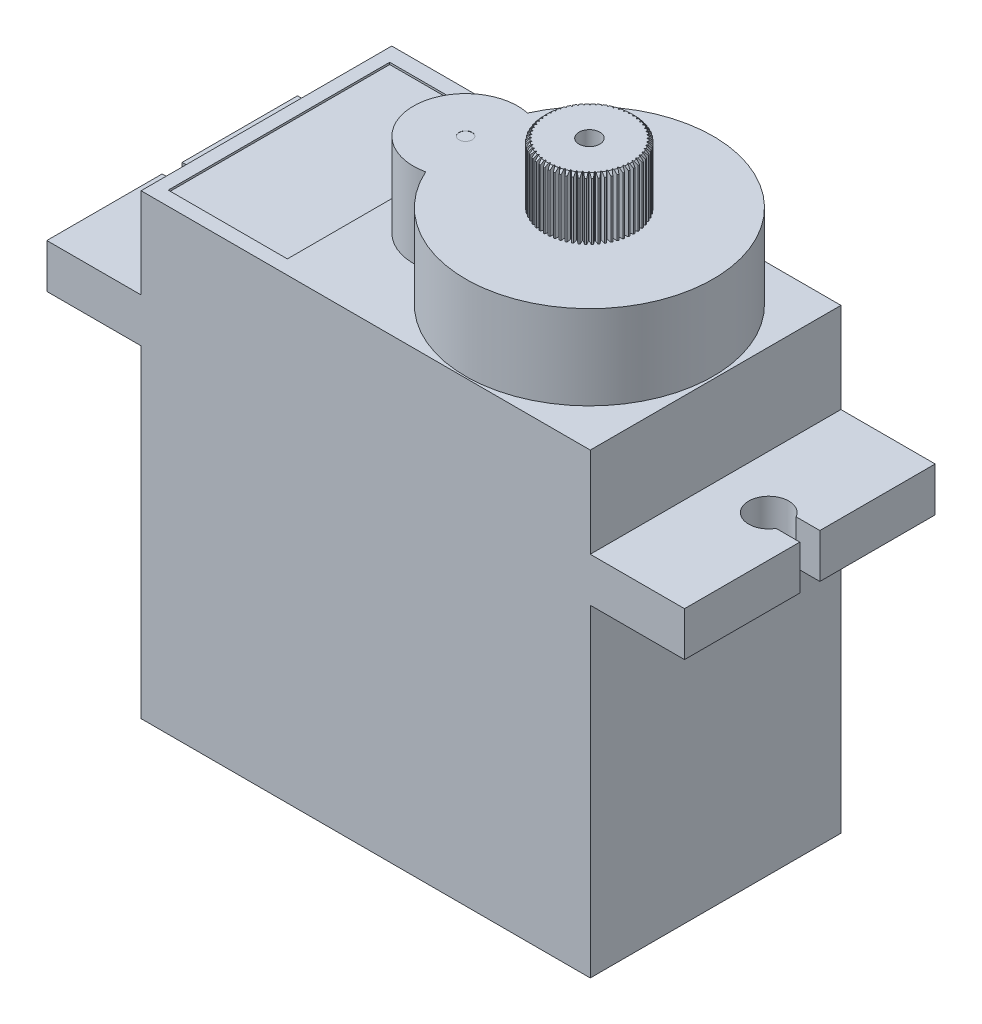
SolidWorks part; units mm, degrees
ref_plane "前视基准面" through (0, 0, 0) normal (0, 0, 1) x (1, 0, 0)
ref_plane "上视基准面" through (0, 0, 0) normal (0, 1, 0) x (1, 0, 0)
ref_plane "右视基准面" through (0, 0, 0) normal (1, 0, 0) x (0, 0, -1)
sketch "草图1" plane through (0, 0, 0) normal (0, 1, 0) x (1, 0, 0)
  line L1 (-11.2, 6.25) -> (11.2, 6.25)
  line L2 (-11.2, 6.25) -> (-11.2, -6.25)
  line L3 (-11.2, -6.25) -> (11.2, -6.25)
  line L4 (11.2, 6.25) -> (11.2, -6.25)
  line L5 (-11.2, 6.25) -> (11.2, -6.25) construction
  line L6 (-11.2, -6.25) -> (11.2, 6.25) construction
  point P0 (0, 0)
extrude "凸台-拉伸1" add sketch "草图1" along normal blind 22.8
sketch "草图2" plane through (11.2, 0, 0) normal (1, 0, 0) x (0, 0, -1)
  line L1 (-6.25, 22.8) -> (-6.25, 0) construction
  line L2 (6.25, 22.8) -> (6.25, 0) construction
  line L3 (-6.25, 16.1) -> (6.25, 16.1)
  line L4 (-6.25, 16.1) -> (-6.25, 18.3)
  line L5 (-6.25, 18.3) -> (6.25, 18.3)
  line L6 (6.25, 16.1) -> (6.25, 18.3)
extrude "凸台-拉伸2" add sketch "草图2" along normal blind 4.7
sketch "草图3" plane through (0, 18.3, 0) normal (0, 1, 0) x (1, 0, 0)
  line L0 (15.9, 0.5) -> (15.9, -0.5)
  line L3 (14.716, -0.5) -> (15.9, -0.5)
  line L4 (14.716, 0.5) -> (15.9, 0.5)
  arc A0 (14.716, 0.5) -> (14.716, -0.5) centre (13.85, 0) ccw
extrude "切除-拉伸1" cut sketch "草图3" against normal blind 4.7
mirror "镜向3" about plane through (0, 0, 0) normal (1, 0, 0) of "切除-拉伸1", "凸台-拉伸2"
sketch "草图4" plane through (0, 22.8, 0) normal (0, 1, 0) x (1, 0, 0)
  arc A0 (-0.7182, 2.5419) -> (-0.7182, -2.5419) centre (-1.2658, 0) ccw
  arc A1 (-0.7182, -2.5419) -> (-0.7182, 2.5419) centre (4.9078, 0) ccw
extrude "凸台-拉伸4" add sketch "草图4" along normal blind 4.2
sketch "草图5" plane through (0, 22.8, 0) normal (0, 1, 0) x (1, 0, 0)
  line L1 (-10.5494, 5.498) -> (-4.6074, 5.498)
  line L2 (-10.5494, 5.498) -> (-10.5494, -5.5468)
  line L3 (-10.5494, -5.5468) -> (-4.6074, -5.5468)
  line L4 (-4.6074, 5.498) -> (-4.6074, -5.5468)
extrude "切除-拉伸3" cut sketch "草图5" against normal blind 0.1
sketch "草图6" plane through (0, 27, 0) normal (0, 1, 0) x (1, 0, 0)
  circle A0 centre (4.9078, 0) radius 2.25
extrude "凸台-拉伸5" add sketch "草图6" along normal blind 3
sketch "草图7" plane through (0, 30, 0) normal (0, 1, 0) x (1, 0, 0)
  circle A0 centre (4.9078, 0) radius 0.52
extrude "切除-拉伸4" cut sketch "草图7" against normal blind 4
sketch "草图8" plane through (0, 27, 0) normal (0, 1, 0) x (1, 0, 0)
  circle A0 centre (-1.2658, 0) radius 0.3248
extrude "切除-拉伸5" cut sketch "草图8" against normal blind 0.01
sketch "草图9" plane through (0, 0, 0) normal (0, -1, 0) x (1, 0, 0)
  circle A0 centre (-10.4311, 5.559) radius 0.4776
  circle A1 centre (10.2031, 5.559) radius 0.4776
  circle A2 centre (10.2031, -5.5701) radius 0.4776
  circle A3 centre (-10.4311, -5.5701) radius 0.4776
extrude "切除-拉伸6" cut sketch "草图9" against normal blind 0.01
chamfer "倒角1" distance 0.15 angle 45 1 edges at (4.9078, 30, 2.25)
sketch "草图11" plane through (0, 30, 0) normal (0, 1, 0) x (1, 0, 0)
  line L0 (3.3608, -1.7288) -> (3.6004, -1.5621)
  line L1 (3.6004, -1.5621) -> (3.6217, -1.577)
  line L2 (3.6217, -1.577) -> (3.5376, -1.8057)
  line L3 (3.5376, -1.8057) -> (3.3608, -1.7288)
extrude "切除-拉伸10" cut sketch "草图11" against normal blind 3
pattern_circular "阵列(圆周)2" count 65 over 360 about axis through (4.9078, 29.85, 0) along (0, 1, 0) of "切除-拉伸10"
